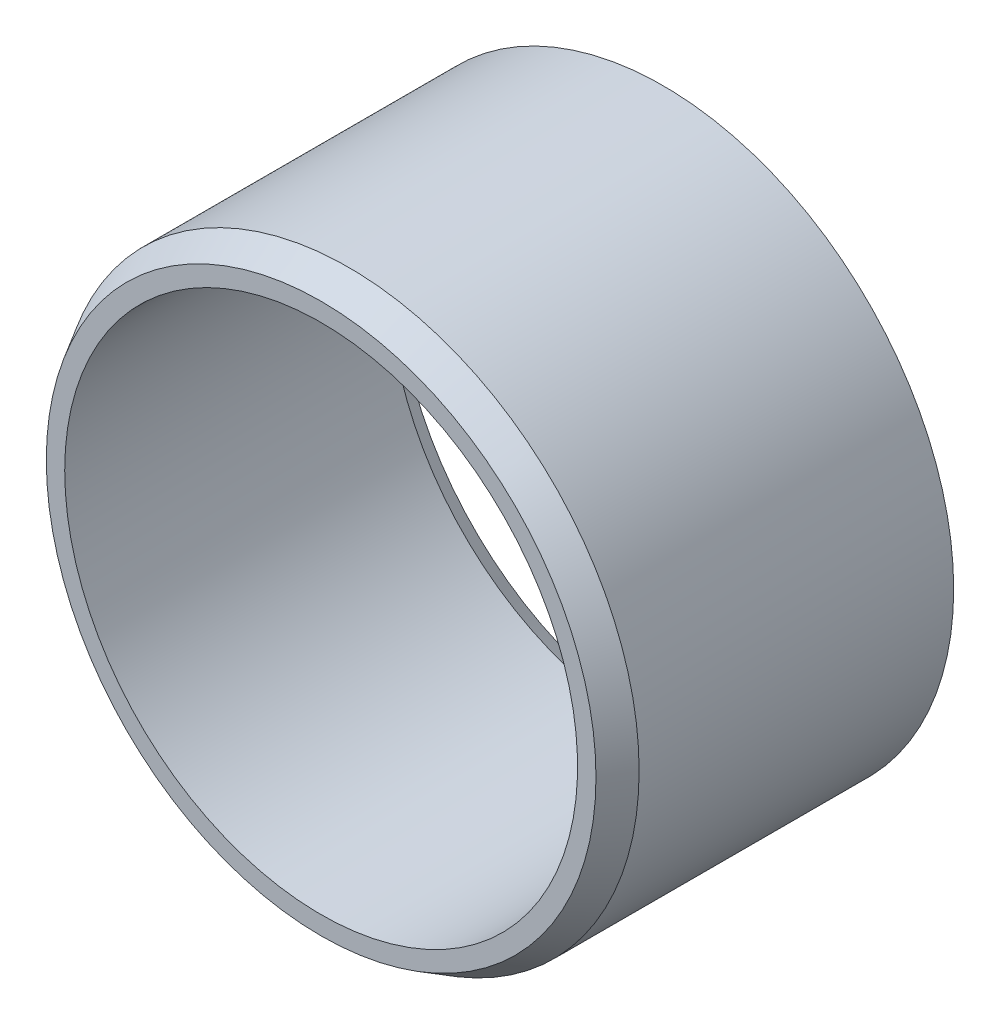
SolidWorks part; units mm, degrees
ref_plane "Front" through (0, 0, 0) normal (0, 0, 1) x (1, 0, 0)
ref_plane "Top" through (0, 0, 0) normal (0, 1, 0) x (1, 0, 0)
ref_plane "Right" through (0, 0, 0) normal (1, 0, 0) x (0, 0, -1)
sketch "Esquisse1" plane through (0, 0, 0) normal (1, 0, 0) x (0, 0, -1)
  line L0 (0, 0) -> (-31.822, 0) construction
  line L1 (-31.822, 7.5) -> (-31.822, 8.5)
  line L2 (-31.822, 8.5) -> (-21.822, 8.5)
  line L4 (0, 0) -> (-31.822, 0) construction
  line L5 (-31.822, 7.5) -> (-21.822, 7.5)
  line L6 (-21.822, 7.5) -> (-21.822, 8.5)
  dimension "D1" = 15
  dimension "D2" = 10
  dimension "D3" = 17
revolve "Révolution1" add sketch "Esquisse1" angle 360 about L0
chamfer "Chanfrein1" distance 0.5 angle 30 1 edges at (-7.5, 0, 21.822)
chamfer "Chanfrein2" distance 0.8 angle 30 1 edges at (-8.5, 0, 31.822)
